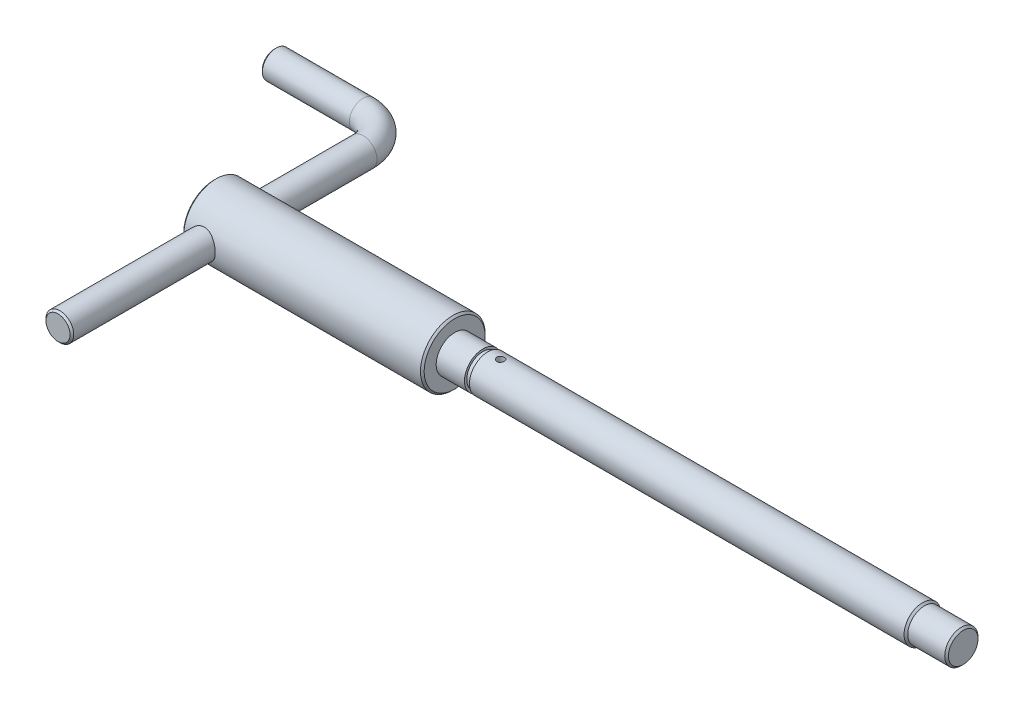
SolidWorks part; units mm, degrees
ref_plane "Plan1" through (0, 0, 0) normal (0, 0, 1) x (1, 0, 0)
ref_plane "Plan2" through (0, 0, 0) normal (0, 1, 0) x (1, 0, 0)
ref_plane "Plan3" through (0, 0, 0) normal (1, 0, 0) x (0, 0, -1)
ref_plane "Plan4" through (-63, 0, 0) normal (1, 0, 0) x (0, 0, -1)
sketch "Esquisse3" plane through (0, 0, 0) normal (0, 0, 1) x (1, 0, 0)
  line L0 (0, 0) -> (370.4885, 0) construction
  line L2 (0, 0) -> (0, 17.5)
  line L3 (0, 17.5) -> (130, 17.5)
  line L4 (130, 17.5) -> (130, 10)
  line L5 (130, 10) -> (145.3, 10)
  line L6 (145.3, 10) -> (145.3, 8.75)
  line L7 (145.3, 8.75) -> (148, 8.75)
  line L8 (148, 8.75) -> (148, 10)
  line L9 (148, 10) -> (405, 10)
  line L13 (0, 0) -> (405, 0)
  line L14 (405, 10) -> (405, 0)
  dimension "D1" = 275
  dimension "D2" = 18
  dimension "D4" = 20
  dimension "D5" = 20
  dimension "D6" = 17.5
  dimension "D7" = 35
  dimension "D8" = 130
  dimension "D9" = 2.7
ref_plane "Plan5" through (0, 0, 10) normal (0, 0, 1) x (1, 0, 0)
revolve "Révolution1" add sketch "Esquisse3" angle 360 about L0
sketch "Esquisse4" plane through (0, 0, 10) normal (0, -1, 0) x (1, 0, 0)
  line L1 (0, 7.5) -> (0, -27.5) construction
  line L2 (0, -10) -> (233.6879, -10) construction
  circle A0 centre (154.91, -10) radius 2
  dimension "D1" = 154.91
  dimension "D2" = 4
extrude "Enlèv. mat.-Extru.1" cut sketch "Esquisse4" against normal through all and the other way through all
sketch "Esquisse5" plane through (0, 0, 0) normal (0, 1, 0) x (1, 0, 0)
  line L0 (10.5, -95) -> (10.5, 70)
  line L1 (-7, 87.5) -> (-55, 87.5)
  line L2 (0, 17.5) -> (0, -17.5) construction
  arc A0 (10.5, 70) -> (-7, 87.5) centre (-7, 70) ccw
  point P8 (10.5, 87.5)
  dimension "D5" = 17.5
  dimension "D1" = 10.5
  dimension "D2" = 95
  dimension "D3" = 87.5
  dimension "D4" = 65.5
ref_plane "Plan6" through (0, 0, 95) normal (0, 0, 1) x (1, 0, 0)
sketch "Esquisse6" plane through (0, 0, 95) normal (0, 0, 1) x (1, 0, 0)
  circle A0 centre (10.5, 0) radius 7.5
  dimension "D1" = 15
sweep "Balayage1" add profiles "Esquisse6" path "Esquisse5"
chamfer "Chanfrein1" distance 1 angle 45 2 edges at (18, 0, 95) (-55, 0, -95)
chamfer "Chanfrein2" distance 1 angle 45 1 edges at (405, 0, 10)
sketch "Esquisse7" plane through (405, 0, 0) normal (1, 0, 0) x (0, 0, -1)
  circle A0 centre (0, 0) radius 11
  circle A1 centre (0, 0) radius 9
  dimension "D1" = 22
  dimension "D2" = 18
extrude "Extrusion1" cut sketch "Esquisse7" against normal blind 21
chamfer "Chanfrein3" distance 1 angle 45 2 edges at (384, 0, -10) (405, 0, -9)
chamfer "Chanfrein4" distance 1 angle 45 2 edges at (0, 0, 17.5) (130, 0, 17.5)
thread "Filetage1" pitch 1.5 start angle 0, offset 3, length 0, pitch 1.5, diameter 20
ref_plane "Plan7" through (386, 0, 10) normal (0, -1, 0) x (0, 0, 1)
sketch "Profil de filetage1" plane through (386, 0, 10) normal (0, -1, 0) x (0, 0, 1)
  line L0 (0, 0) -> (0, 1.5) construction
  line L11 (0, 0) -> (0, 1.3125)
  line L12 (0, 1.3125) -> (-0.8119, 0.8437)
  line L13 (-0.8119, 0.8437) -> (-0.8119, 0.4687)
  line L15 (-0.8119, 0.4687) -> (0, 0)
  line L17 (-0.8119, 0.6562) -> (0, 0.6562) construction
  point P2 (0, 0)
  dimension "Pitch" = 1.5
  dimension "Profile_Angle" = 60
  dimension "Profile_Land" = 0.375
  dimension "Profile_Height" = 0.8119
